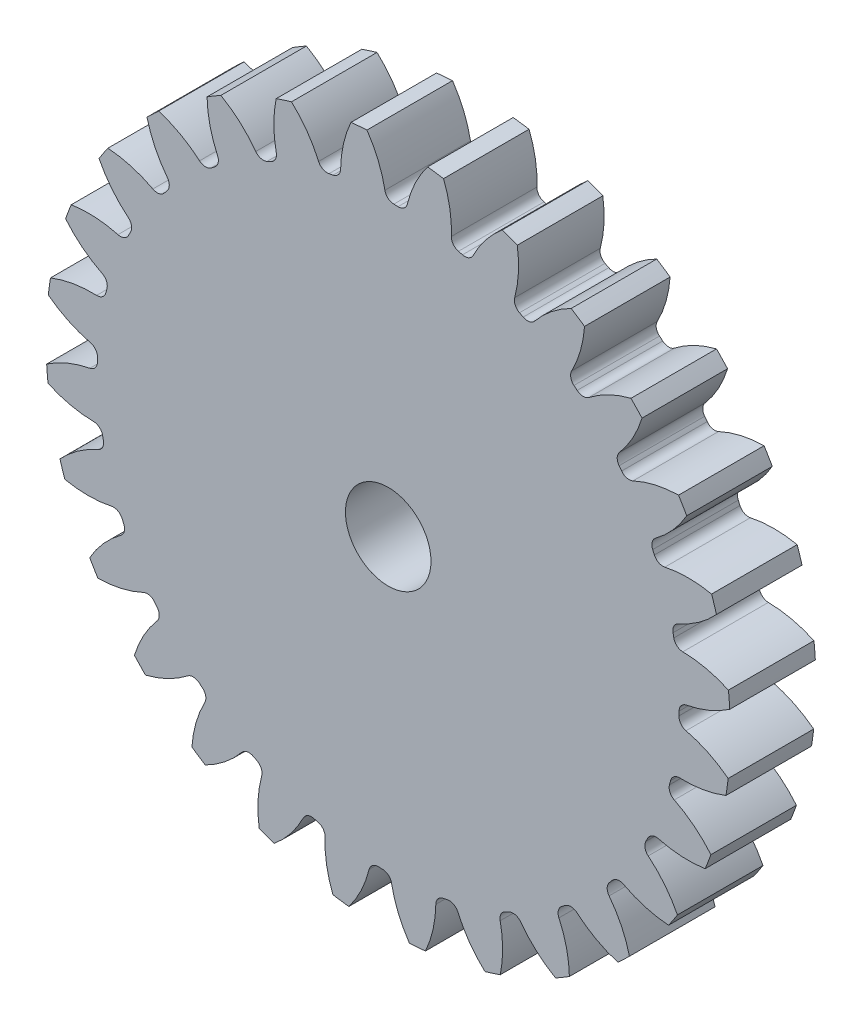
SolidWorks part; units mm, degrees
ref_plane "Front" through (0, 0, 0) normal (0, 0, 1) x (1, 0, 0)
ref_plane "Top" through (0, 0, 0) normal (0, 1, 0) x (1, 0, 0)
ref_plane "Right" through (0, 0, 0) normal (1, 0, 0) x (0, 0, -1)
sketch "Sketch3" plane through (0, 0, 0) normal (0, 0, 1) x (1, 0, 0)
  circle A0 centre (0, 0) radius 508
  dimension "od" = 1016
extrude "gearBody" add sketch "Sketch3" along normal blind 127
sketch "Sketch2" plane through (0, 0, 0) normal (0, 0, 1) x (1, 0, 0)
  line L0 (0, 0) -> (411.6249, 170.5006) construction
  line L1 (505.5712, -59.1802) -> (0, 0) construction
  line L2 (0, 0) -> (36.3143, 0) construction
  line L3 (473.929, 13.9193) -> (472.5217, -39.0598) construction
  line L5 (473.2253, -12.5702) -> (0, 0) construction
  line L7 (0, 0) -> (445.5396, 0) construction
  arc A0 (445.5066, 5.4203) -> (444.5906, -29.0638) centre (0, 0) ccw construction
  arc A1 (507.0176, 31.5772) -> (504.6263, -58.4494) centre (0, 0) ccw construction
  arc A2 (473.929, 13.9193) -> (472.5217, -39.0598) centre (0, 0) ccw construction
  arc A3 (431.5542, -14.5683) -> (431.719, -8.3627) centre (0, 0) ccw
  arc A4 (505.5712, -59.1802) -> (442.0534, -28.422) centre (401.9929, -192.1127) ccw
  arc A5 (505.5712, -59.1802) -> (508, 32.2569) centre (0, 0) ccw
  arc A6 (508, 32.2569) -> (442.9389, 4.914) centre (411.6249, 170.5006) cw
  arc A7 (431.719, -8.3627) -> (442.9389, 4.914) centre (445.5002, -8.6297) cw
  arc A8 (442.0534, -28.422) -> (431.5542, -14.5683) centre (445.3301, -15.0333) cw
  point P6 (508, 32.2569)
  point P22 (505.5712, -59.1802)
  dimension "baseDia" = 891.0792
  dimension "od" = 1016
  dimension "pd" = 948.2667
  dimension "rd" = 863.6
  dimension "rFillet" = 13.7837
  dimension "pointX" = 508
  dimension "pointY" = 32.2569
  dimension "CTT" = 52.9791
  dimension "flankCenterAngle" = 22.5
extrude "toothCut" cut sketch "Sketch2" along normal through all
pattern_circular "CirPattern1" count 28 over 360 about axis through (0, 0, 0) along (0, 0, 1) of "toothCut"
sketch "hub1Dia" plane through (0, 0, 0) normal (0, 0, -1) x (-1, 0, 0)
  circle A0 centre (0, 0) radius 12.7
  dimension "hub1Dia" = 25.4
sketch "hub2Dia" plane through (0, 0, 127) normal (0, 0, 1) x (1, 0, 0)
  circle A0 centre (0, 0) radius 12.7
  dimension "hub2dia" = 25.4
sketch "boreDia" plane through (0, 0, 0) normal (0, 0, 1) x (1, 0, 0)
  circle A0 centre (0, 0) radius 63.5
  dimension "boreDia" = 127
extrude "bore" cut sketch "boreDia" against normal mid plane 25400
